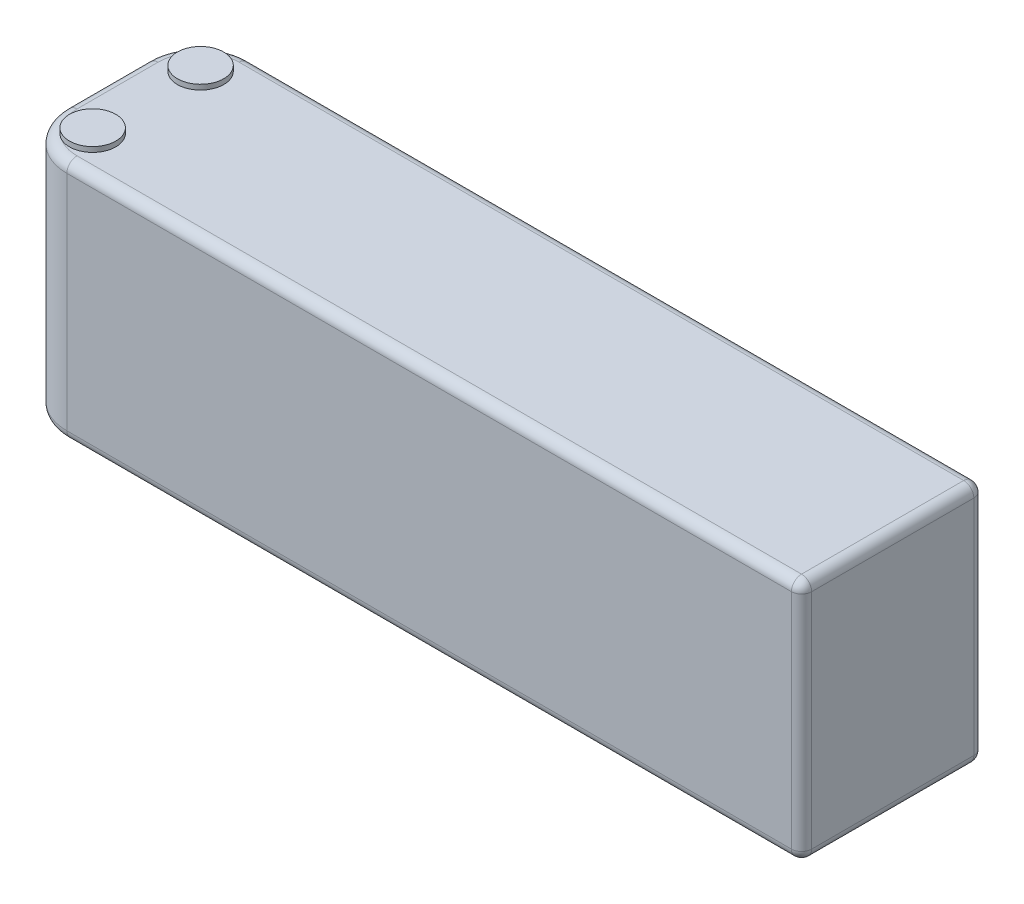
SolidWorks part; units mm, degrees
ref_plane "Front Plane" through (0, 0, 0) normal (0, 0, 1) x (1, 0, 0)
ref_plane "Top Plane" through (0, 0, 0) normal (0, 1, 0) x (1, 0, 0)
ref_plane "Right Plane" through (0, 0, 0) normal (1, 0, 0) x (0, 0, -1)
sketch "Sketch3" plane through (0, 0, 0) normal (0, 1, 0) x (1, 0, 0)
  line L0 (10, 0) -> (155, 0)
  line L1 (155, 0) -> (155, 36)
  line L2 (155, 36) -> (10, 36)
  line L3 (0, 26) -> (0, 10)
  arc A0 (10, 36) -> (0, 26) centre (10, 26) ccw
  arc A1 (10, 0) -> (0, 10) centre (10, 10) cw
  point P10 (0, 0)
  dimension "D1" = 10
extrude "Boss-Extrude1" add sketch "Sketch3" along normal blind 48
fillet "Fillet1" radius 2 14 edges at (82.5, 48, -36) (82.5, 0, 0) (155, 24, -36) (155, 0, -18) (82.5, 48, 0) (82.5, 0, -36) (155, 48, -18) (155, 24, 0) (2.9289, 48, -33.0711) (0, 48, -18) (2.9289, 48, -2.9289) (2.9289, 0, -2.9289) (0, 0, -18) (2.9289, 0, -33.0711)
ref_plane "Plane1" through (0, 24, 0) normal (0, 1, 0) x (1, 0, 0)
sketch "Sketch7" plane through (0, 48, 0) normal (0, 1, 0) x (1, 0, 0)
  line L0 (0, 18) -> (18.781, 18) construction
  line L1 (0, 10) -> (0, 26) construction
  circle A1 centre (7.7381, 28.6509) radius 4.5727
  circle A2 centre (7.7381, 7.3491) radius 4.5727
extrude "Boss-Extrude3" add sketch "Sketch7" along normal blind 1
